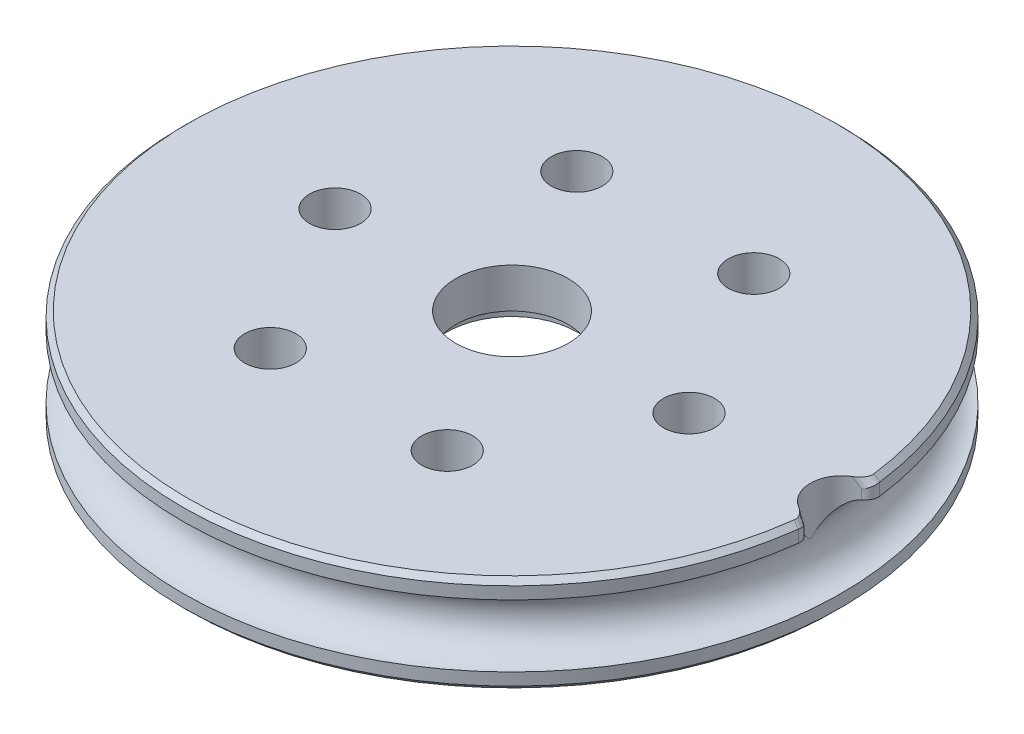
SolidWorks part; units mm, degrees
ref_plane "Front Plane" through (0, 0, 0) normal (0, 0, 1) x (1, 0, 0)
ref_plane "Top Plane" through (0, 0, 0) normal (0, 1, 0) x (1, 0, 0)
ref_plane "Right Plane" through (0, 0, 0) normal (1, 0, 0) x (0, 0, -1)
sketch "Sketch1" plane through (0, 0, 0) normal (0, 1, 0) x (1, 0, 0)
  line L0 (3.7888, 15.3719) -> (8.2703, 33.5537) construction
  circle A0 centre (0, 0) radius 25 construction
  circle A1 centre (0, 25) radius 2
  circle A2 centre (11.6181, 22.1364) radius 2
  circle A3 centre (20.5746, 14.2016) radius 2
  circle A4 centre (24.8177, 3.0134) radius 2
  circle A5 centre (23.3754, -8.8651) radius 2
  circle A6 centre (16.5781, -18.7128) radius 2
  circle A7 centre (5.9829, -24.2735) radius 2
  circle A8 centre (-5.9829, -24.2735) radius 2
  circle A9 centre (-16.5781, -18.7128) radius 2
  circle A10 centre (-23.3754, -8.8651) radius 2
  circle A11 centre (-24.8177, 3.0134) radius 2
  circle A12 centre (-20.5746, 14.2016) radius 2
  arc A16 (1.64, 23.4427) -> (9.4422, 21.5196) centre (5.6239, 22.8171) cw
  arc A17 (12.3466, 19.9953) -> (18.3613, 14.6667) centre (15.5834, 17.59) cw
  arc A18 (20.2246, 11.9672) -> (23.0741, 4.4538) centre (21.9729, 8.3332) cw
  arc A19 (23.4695, 1.1976) -> (22.5009, -6.7794) centre (23.3287, -2.8326) cw
  arc A20 (21.3377, -9.8464) -> (16.773, -16.4596) centre (19.3401, -13.3495) cw
  arc A21 (14.3178, -18.6347) -> (7.2026, -22.369) centre (10.921, -20.8082) cw
  arc A22 (4.0178, -23.154) -> (-4.0178, -23.154) centre (0, -23.5) cw
  arc A23 (-7.2026, -22.369) -> (-14.3178, -18.6347) centre (-10.921, -20.8082) cw
  arc A24 (-16.773, -16.4596) -> (-21.3377, -9.8464) centre (-19.3401, -13.3495) cw
  arc A25 (-22.5009, -6.7794) -> (-23.4695, 1.1976) centre (-23.3287, -2.8326) cw
  arc A26 (-23.0741, 4.4538) -> (-20.2246, 11.9672) centre (-21.9729, 8.3332) cw
  arc A27 (-18.3613, 14.6667) -> (-12.3466, 19.9953) centre (-15.5834, 17.59) cw
  circle A30 centre (0, 0) radius 4 construction
  circle A31 centre (0, 0) radius 23.5 construction
  circle A32 centre (0, 0) radius 32.25
  circle A33 centre (0, 0) radius 1.5
  circle A34 centre (-11.6181, 22.1364) radius 2
  arc A37 (-9.4422, 21.5196) -> (-1.64, 23.4427) centre (-5.6239, 22.8171) cw
extrude "Boss-Extrude1" add sketch "Sketch1" along normal blind 4.5
sketch "Sketch2" plane through (0, 4.5, 0) normal (0, 1, 0) x (1, 0, 0)
  circle A0 centre (0, 0) radius 4 construction
  circle A2 centre (0, 0) radius 4
  circle A3 centre (0, 0) radius 32.25 construction
  circle A4 centre (0, 0) radius 1.5 construction
  circle A6 centre (0, 0) radius 32.25
extrude "Boss-Extrude2" add sketch "Sketch2" along normal blind 5
sketch "Sketch3" plane through (0, 9.5, 0) normal (0, 1, 0) x (1, 0, 0)
  line L1 (8.6603, 15) -> (-8.6603, 15) construction
  line L2 (-8.6603, 15) -> (-17.3205, 0) construction
  line L3 (-17.3205, 0) -> (-8.6603, -15) construction
  line L4 (-8.6603, -15) -> (8.6603, -15) construction
  line L5 (8.6603, -15) -> (17.3205, 0) construction
  line L6 (17.3205, 0) -> (8.6603, 15) construction
  circle A0 centre (0, 0) radius 15 construction
  circle A1 centre (-8.6603, 15) radius 2.5
  circle A2 centre (8.6603, 15) radius 2.5
  circle A3 centre (17.3205, 0) radius 2.5
  circle A4 centre (8.6603, -15) radius 2.5
  circle A5 centre (-8.6603, -15) radius 2.5
  circle A6 centre (-17.3205, 0) radius 2.5
  dimension "D1" = 5
  dimension "D2" = 30
extrude "Cut-Extrude1" cut sketch "Sketch3" against normal through all
sketch "Sketch5" plane through (0, 0, 0) normal (0, 0, 1) x (1, 0, 0)
  line L0 (-3, 11.5) -> (-3, 4.5)
  line L1 (-3, 4.5) -> (-6.4, 4.5)
  line L2 (-6.4, 4.5) -> (-6.4, 5.6)
  line L3 (-6.4, 5.6) -> (-5.5, 5.6)
  line L4 (-5.5, 5.6) -> (-5.5, 11.5)
  line L5 (-5.5, 11.5) -> (-3, 11.5)
  line L6 (0, 0) -> (0, 27.5187) construction
  line L7 (-19.8205, 4.5) -> (-14.8205, 4.5) construction
  line L10 (1.5, 0) -> (-1.5, 0) construction
  dimension "D1" = 12.8
  dimension "D2" = 6
  dimension "D3" = 11
  dimension "D4" = 1.1
  dimension "D5" = 7
revolve "Cut-Revolve1" cut sketch "Sketch5" angle 360 about L6
chamfer "Chamfer3" distance 0.5 angle 45 2 edges at (0, 0, 32.25) (0, 9.5, 32.25)
sketch "Sketch6" plane through (0, 0, 0) normal (0, -1, 0) x (1, 0, 0)
  circle A0 centre (0, 0) radius 25
  circle A1 centre (-5.9829, 24.2735) radius 1
  circle A2 centre (6.7008, 27.1864) radius 1
  circle A3 centre (19.2854, 23.8711) radius 1
  circle A4 centre (28.8878, 15.0873) radius 1
  circle A5 centre (33.3082, 2.8471) radius 1
  circle A6 centre (31.534, -10.0453) radius 1
  circle A7 centre (23.9717, -20.6364) radius 1
  circle A8 centre (12.3536, -26.5) radius 1
  circle A9 centre (-0.6586, -26.2928) radius 1
  circle A10 centre (-12.0841, -20.0622) radius 1
  circle A11 centre (-19.3054, -9.2356) radius 1
  circle A12 centre (-20.6681, 3.7068) radius 1
  circle A13 centre (-15.8601, 15.7999) radius 1
  dimension "D2" = 2
  dimension "D1" = 13
sketch "Sketch7" plane through (0, 0, 0) normal (0, 0, 1) x (1, 0, 0)
  line L0 (32.25, 0.5) -> (32.25, 9) construction
  line L1 (0, 0) -> (0, 20.9814) construction
  circle A0 centre (32.25, 4.75) radius 3.05
  dimension "D1" = 6.1
revolve "Cut-Revolve2" cut sketch "Sketch7" angle 360 about L1
sketch "Sketch8" plane through (0, 9.5, 0) normal (0, 1, 0) x (1, 0, 0)
  circle A0 centre (32.25, 0) radius 3.05
  circle A1 centre (0, 0) radius 32.25 construction
  dimension "D1" = 6.1
extrude "Cut-Extrude2" cut sketch "Sketch8" against normal up to surface (1.7034 mm away) contours A0
fillet "Fillet1" radius 1 4 edges at (32.1058, 8.4, -3.0466) (32.1058, 8.4, 3.0466)
equation "\"N\"= 13"
equation "\"Rr\" = 2"
equation "\"R\"= 25"
equation "\"E\"= 1.5"
equation "\"D3@Sketch1\"=\"N\""
equation "\"D7@Sketch1\"=\"N\""
equation "\"D2@Sketch1\"=\"Rr\" * 2"
equation "\"D1@Sketch1\"=\"R\" * 2"
